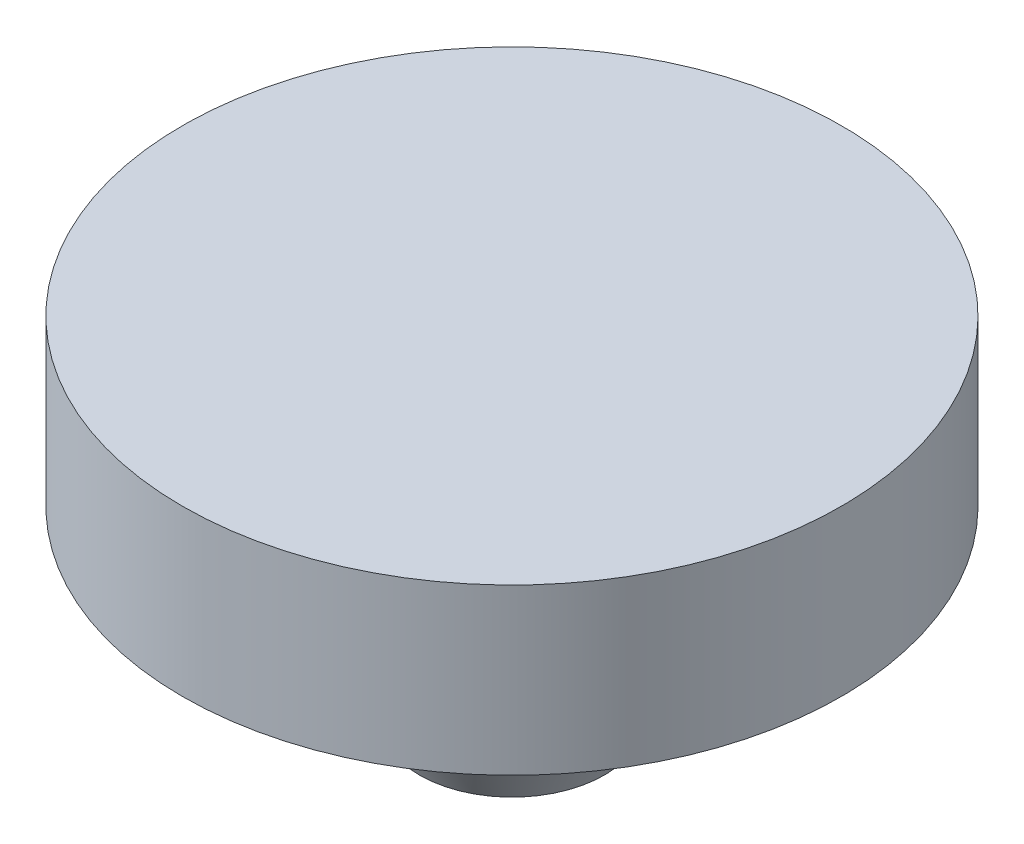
SolidWorks part; units mm, degrees
ref_plane "Front Plane" through (0, 0, 0) normal (0, 0, 1) x (1, 0, 0)
ref_plane "Top Plane" through (0, 0, 0) normal (0, 1, 0) x (1, 0, 0)
ref_plane "Right Plane" through (0, 0, 0) normal (1, 0, 0) x (0, 0, -1)
sketch "Sketch1" plane through (0, 0, 0) normal (0, 1, 0) x (1, 0, 0)
  circle A0 centre (0, 0) radius 12.7
  dimension "D1" = 25.4
extrude "Boss-Extrude1" add sketch "Sketch1" along normal blind 6.35
sketch "Sketch2" plane through (0, 0, 0) normal (0, -1, 0) x (1, 0, 0)
  circle A0 centre (0, 0) radius 4.7625
  dimension "D1" = 9.525
extrude "Boss-Extrude2" add sketch "Sketch2" along normal blind 2.286
sketch "Sketch3" plane through (0, 0, 0) normal (1, 0, 0) x (0, 0, -1)
  line L0 (0, 0) -> (0, -8.3802) construction
  line L1 (-4.7625, -2.286) -> (4.7625, -2.286) construction
  line L2 (0, -2.286) -> (6.35, -2.286)
  line L3 (0, -7.1882) -> (3.5687, -7.1882)
  line L4 (3.5687, -7.1882) -> (6.35, -2.286)
  line L5 (0, -2.286) -> (0, -7.1882)
  line L6 (12.7, 6.35) -> (-12.7, 6.35) construction
  dimension "D1" = 7.1374
  dimension "D2" = 12.7
  dimension "D3" = 13.5382
revolve "Revolve1" add sketch "Sketch3" angle 360 about L0
